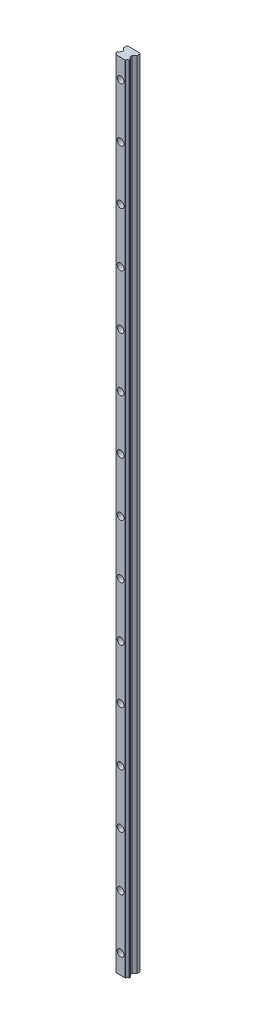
SolidWorks part; units mm, degrees
ref_plane "Front Plane" through (0, 0, 0) normal (0, 0, 1) x (1, 0, 0)
ref_plane "Top Plane" through (0, 0, 0) normal (0, 1, 0) x (1, 0, 0)
ref_plane "Right Plane" through (0, 0, 0) normal (1, 0, 0) x (0, 0, -1)
imported_body "Imported3"
sketch "Sketch1" plane through (0, 1.7999, 0) normal (0, 1, 0) x (-1, 0, 0)
  line L0 (-22.3768, -10.8396) -> (-23, -10.8396)
  line L1 (-23, -10.8396) -> (-23, -10.8812)
  arc A0 (-23, -10.8812) -> (-22.3768, -10.8396) centre (-22.3564, -15.8396) cw
extrude "Cut-Extrude1" cut sketch "Sketch1" against normal blind 6
sketch "Sketch2" plane through (0, -32.7001, 0) normal (0, -1, 0) x (1, 0, 0)
  line L0 (23, -10.8396) -> (22.3768, -10.8396)
  line L1 (23, -10.8812) -> (23, -10.8396)
  arc A0 (22.3768, -10.8396) -> (23, -10.8812) centre (22.3564, -15.8396) cw
extrude "Cut-Extrude2" cut sketch "Sketch2" against normal blind 6
sketch "Sketch3" plane through (0, -32.7001, 0) normal (0, -1, 0) x (1, 0, 0)
  line L0 (23, -7.3502) -> (23, -10.8396)
  line L1 (23, -10.8396) -> (16, -10.8396)
  line L2 (16, -10.8396) -> (16, -19.65)
  line L3 (16, -19.65) -> (-16, -19.65)
  line L4 (-16, -19.65) -> (-16, -6.8502)
  line L5 (-16, -6.8502) -> (23.5, -6.8502)
  line L6 (23.5, -6.8502) -> (23, -7.3502)
extrude "Boss-Extrude1" add sketch "Sketch3" along normal blind 2.4
ref_plane "Plane1" through (0, -26.7001, 0) normal (0, -1, 0) x (1, 0, 0)
sketch "Sketch4" plane through (0, -26.7001, 0) normal (0, -1, 0) x (1, 0, 0)
  line L0 (22.336, -10.8396) -> (22.3768, -10.8396)
  arc A0 (22.3768, -10.8396) -> (22.336, -10.8396) centre (22.3564, -15.8396) ccw
extrude "Cut-Extrude3" cut sketch "Sketch4" against normal blind 22.5
sketch "Sketch5" plane through (0, -35.1001, 0) normal (0, -1, 0) x (1, 0, 0)
  line L0 (23.5, -6.8502) -> (23, -6.8502)
  line L1 (23, -6.8502) -> (23, -7.3502)
  line L2 (23, -7.3502) -> (23.5, -6.8502)
extrude "Cut-Extrude4" cut sketch "Sketch5" against normal blind 8.4
sketch "Sketch6" plane through (0, 1.7999, 0) normal (0, 1, 0) x (-1, 0, 0)
  line L0 (-23.5, -6.8502) -> (-23, -7.3502)
  line L1 (-23, -7.3502) -> (-23, -6.8502)
  line L2 (-23, -6.8502) -> (-23.5, -6.8502)
extrude "Cut-Extrude5" cut sketch "Sketch6" against normal blind 6
sketch "Sketch7" plane through (23, 0, 0) normal (1, 0, 0) x (0, 0, -1)
  line L0 (6.8502, 1.7999) -> (10.8396, 1.7999)
  line L1 (10.8396, 1.7999) -> (10.8396, -4.2001)
  line L2 (10.8396, -4.2001) -> (6.8502, -4.2001)
  line L3 (6.8502, -4.2001) -> (6.8502, 1.7999)
extrude "Boss-Extrude2" add sketch "Sketch7" along normal blind 0.5
sketch "Sketch8" plane through (0, 0, -19.65) normal (0, 0, -1) x (-1, 0, 0)
  line L0 (19, -4.2001) -> (20.8437, -4.2001)
  line L1 (20.8437, -4.2001) -> (20.8437, 1.7999)
  line L2 (20.8437, 1.7999) -> (16, 1.7999)
  arc A0 (16, 1.7999) -> (19, -4.2001) centre (19, -0.4501) ccw
extrude "Cut-Extrude6" cut sketch "Sketch8" against normal blind 7.5181
sketch "Sketch9" plane through (0, 0, -12.1319) normal (0, 0, -1) x (-1, 0, 0)
  line L0 (19, -4.2001) -> (20.8437, -4.2001)
  line L1 (20.8437, -4.2001) -> (20.8437, 1.7999)
  line L2 (20.8437, 1.7999) -> (16, 1.7999)
  arc A0 (16, 1.7999) -> (19, -4.2001) centre (19, -0.4501) ccw
extrude "Cut-Extrude7" cut sketch "Sketch9" against normal blind 1.2817
sketch "Sketch10" plane through (23, 0, 0) normal (1, 0, 0) x (0, 0, -1)
  line L0 (6.8502, -26.7001) -> (10.8396, -26.7001)
  line L1 (10.8396, -26.7001) -> (10.8396, -35.1001)
  line L2 (10.8396, -35.1001) -> (6.8502, -35.1001)
  line L3 (6.8502, -35.1001) -> (6.8502, -26.7001)
extrude "Boss-Extrude3" add sketch "Sketch10" along normal blind 0.5
sketch "Sketch11" plane through (0, 0, -6.8502) normal (0, 0, 1) x (1, 0, 0)
  line L0 (-20.8437, -35.1001) -> (-20.8437, 1.7999)
  line L1 (-20.8437, 1.7999) -> (23.5, 1.7999)
  line L2 (23.5, 1.7999) -> (23.5, -35.1001)
  line L3 (23.5, -35.1001) -> (-20.8437, -35.1001)
extrude "Boss-Extrude4" add sketch "Sketch11" along normal blind 7
sketch "Sketch12" plane through (0, 0, -10.8396) normal (0, 0, -1) x (-1, 0, 0)
  line L0 (-16, 1.7999) -> (-23.5, 1.7999)
  line L1 (-23.5, 1.7999) -> (-23.5, -4.2001)
  line L2 (-23.5, -4.2001) -> (-23, -4.2001)
  line L3 (-23, -4.2001) -> (-19, -4.2001)
  arc A0 (-19, -4.2001) -> (-16, 1.7999) centre (-19, -0.4501) ccw
extrude "Cut-Extrude8" cut sketch "Sketch12" against normal blind 3.4894
sketch "Sketch13" plane through (0, 0, -10.8396) normal (0, 0, -1) x (-1, 0, 0)
  line L0 (-16, -35.1001) -> (-16, -32.7001)
  line L1 (-19, -26.7001) -> (-23, -26.7001)
  line L2 (-23, -26.7001) -> (-23.5, -26.7001)
  line L3 (-23.5, -26.7001) -> (-23.5, -35.1001)
  line L4 (-23.5, -35.1001) -> (-16, -35.1001)
  arc A0 (-16, -32.7001) -> (-19, -26.7001) centre (-19, -30.4501) ccw
extrude "Cut-Extrude9" cut sketch "Sketch13" against normal blind 3.4894
sketch "Sketch14" plane through (0, 0, -7.3502) normal (0, 0, -1) x (-1, 0, 0)
  line L0 (-16, -35.1001) -> (-16, -32.7001)
  line L1 (-19, -26.7001) -> (-23.5, -26.7001)
  line L2 (-23.5, -26.7001) -> (-23.5, -35.1001)
  line L3 (-23.5, -35.1001) -> (-16, -35.1001)
  arc A0 (-16, -32.7001) -> (-19, -26.7001) centre (-19, -30.4501) ccw
extrude "Cut-Extrude10" cut sketch "Sketch14" against normal blind 0.5
sketch "Sketch15" plane through (-20.8437, 0, 0) normal (-1, 0, 0) x (0, 0, 1)
  line L0 (-10.8502, 1.7999) -> (0.1498, 1.7999)
  line L1 (0.1498, 1.7999) -> (0.1498, -35.1001)
  line L2 (0.1498, -35.1001) -> (-6.8502, -35.1001)
  line L3 (-6.8502, -35.1001) -> (-6.8502, -26.7001)
  line L4 (-6.8502, -26.7001) -> (-10.8502, -26.7001)
  line L5 (-10.8502, -26.7001) -> (-10.8502, 1.7999)
extrude "Boss-Extrude5" add sketch "Sketch15" along normal blind 2.6563
sketch "Sketch16" plane through (0, 0, -7.3502) normal (0, 0, -1) x (-1, 0, 0)
  line L0 (-16, 1.7999) -> (-23.5, 1.7999)
  line L1 (-23.5, 1.7999) -> (-23.5, -4.2001)
  line L2 (-23.5, -4.2001) -> (-19, -4.2001)
  arc A0 (-19, -4.2001) -> (-16, 1.7999) centre (-19, -0.4501) ccw
extrude "Cut-Extrude11" cut sketch "Sketch16" against normal blind 0.5
sketch "Sketch17" plane through (0, 0, -10.8502) normal (0, 0, -1) x (-1, 0, 0)
  line L0 (23.5, -4.2001) -> (23.5, 1.7999)
  line L1 (23.5, 1.7999) -> (16, 1.7999)
  line L2 (19, -4.2001) -> (23.5, -4.2001)
  arc A0 (16, 1.7999) -> (19, -4.2001) centre (19, -0.4501) ccw
extrude "Cut-Extrude12" cut sketch "Sketch17" against normal blind 4
sketch "Sketch18" plane through (0, 1.7999, 0) normal (0, 1, 0) x (-1, 0, 0)
  line L0 (-23.5, 0.1498) -> (23.5, 0.1498)
  line L1 (23.5, 0.1498) -> (23.5, -6.8502)
  line L2 (23.5, -6.8502) -> (16, -6.8502)
  line L3 (16, -6.8502) -> (16, -19.65)
  line L4 (16, -19.65) -> (-16, -19.65)
  line L5 (-16, -19.65) -> (-16, -6.8502)
  line L6 (-16, -6.8502) -> (-23.5, -6.8502)
  line L7 (-23.5, -6.8502) -> (-23.5, 0.1498)
extrude "Boss-Extrude6" add sketch "Sketch18" along normal blind 2.4
sketch "Sketch19" plane through (0, -35.1001, 0) normal (0, -1, 0) x (1, 0, 0)
  line L0 (-16, -19.65) -> (-15.5939, -19.65)
  line L1 (-16, -16.8291) -> (-16, -19.65)
  arc A0 (-15.5939, -19.65) -> (-16, -16.8291) centre (-25.5939, -19.65) ccw
extrude "Cut-Extrude13" cut sketch "Sketch19" against normal up to next
sketch "Sketch20" plane through (0, -35.1001, 0) normal (0, -1, 0) x (1, 0, 0)
  line L0 (16, -19.65) -> (16, -16.8291)
  line L1 (15.5939, -19.65) -> (16, -19.65)
  arc A0 (16, -16.8291) -> (15.5939, -19.65) centre (25.5939, -19.65) ccw
extrude "Cut-Extrude14" cut sketch "Sketch20" against normal up to next
sketch "Sketch21" plane through (0, -35.1001, 0) normal (0, -1, 0) x (1, 0, 0)
  line L0 (15.6, -19.65) -> (-15.6, -19.65)
  line L1 (-15.6, -19.65) -> (-15.6, -0.65)
  line L2 (-15.6, -0.65) -> (15.6, -0.65)
  line L3 (15.6, -0.65) -> (15.6, -19.65)
extrude "Boss-Extrude7" add sketch "Sketch21" along normal blind 8.5
sketch "Sketch22" plane through (0, 4.1999, 0) normal (0, 1, 0) x (-1, 0, 0)
  line L0 (15.5939, -19.65) -> (16, -19.65)
  line L1 (16, -19.65) -> (16, -16.8291)
  arc A0 (16, -16.8291) -> (15.5939, -19.65) centre (25.5939, -19.65) ccw
extrude "Cut-Extrude15" cut sketch "Sketch22" against normal up to next
sketch "Sketch23" plane through (0, 4.1999, 0) normal (0, 1, 0) x (-1, 0, 0)
  line L0 (-16, -16.8291) -> (-16, -19.65)
  line L1 (-16, -19.65) -> (-15.5939, -19.65)
  arc A0 (-15.5939, -19.65) -> (-16, -16.8291) centre (-25.5939, -19.65) ccw
extrude "Cut-Extrude16" cut sketch "Sketch23" against normal up to next
sketch "Sketch24" plane through (0, 4.1999, 0) normal (0, 1, 0) x (-1, 0, 0)
  line L0 (15.6, -19.65) -> (-15.6, -19.65)
  line L1 (-15.6, -19.65) -> (-15.6, -0.65)
  line L2 (-15.6, -0.65) -> (15.6, -0.65)
  line L3 (15.6, -0.65) -> (15.6, -19.65)
extrude "Boss-Extrude8" add sketch "Sketch24" along normal blind 8.5
sketch "Sketch25" plane through (0, 4.1999, 0) normal (0, 1, 0) x (-1, 0, 0)
  line L0 (-4.5004, 0.1498) -> (-13.5005, 0.1498)
  line L1 (-13.5005, 0.1498) -> (-13.0005, -0.3502)
  line L2 (-13.0005, -0.3502) -> (-5.0004, -0.3502)
  line L3 (-5.0004, -0.3502) -> (-4.5004, 0.1498)
extrude "Cut-Extrude17" cut sketch "Sketch25" against normal through all
sketch "Sketch26" plane through (0, 4.1999, 0) normal (0, 1, 0) x (-1, 0, 0)
  line L0 (13.5, 0.1498) -> (4.5, 0.1498)
  line L1 (4.5, 0.1498) -> (4.9998, -0.35)
  line L2 (4.9998, -0.35) -> (13.0002, -0.35)
  line L3 (13.0002, -0.35) -> (13.5, 0.1498)
extrude "Cut-Extrude18" cut sketch "Sketch26" against normal through all
sketch "Sketch27" plane through (0, 12.6999, 0) normal (0, 1, 0) x (-1, 0, 0)
  line L0 (7.4011, -19.65) -> (4.73, -16.9789)
  line L1 (4.73, -16.9789) -> (4.73, -15.0209)
  line L2 (4.73, -15.0209) -> (5.4472, -14.3037)
  line L3 (7.43, -12.6044) -> (7.43, -10.8955)
  line L4 (5.4544, -8.9199) -> (-5.4544, -8.9199)
  line L5 (-7.43, -10.8955) -> (-7.43, -12.6044)
  line L6 (-5.4472, -14.3037) -> (-4.73, -15.0209)
  line L7 (-4.73, -15.0209) -> (-4.73, -16.9789)
  line L8 (-4.73, -16.9789) -> (-7.4011, -19.65)
  line L9 (-7.4011, -19.65) -> (7.4011, -19.65)
  arc A0 (5.4472, -14.3037) -> (7.43, -12.6044) centre (7.2449, -14.3948) cw
  arc A1 (7.43, -10.8955) -> (5.4544, -8.9199) centre (7.2449, -9.105) cw
  arc A2 (-5.4544, -8.9199) -> (-7.43, -10.8955) centre (-7.2449, -9.105) cw
  arc A3 (-7.43, -12.6044) -> (-5.4472, -14.3037) centre (-7.2449, -14.3948) cw
extrude "Cut-Extrude19" cut sketch "Sketch27" against normal through all
hole_wizard "CBORE for M2.5 Hex Head Machine Screw1" positions "Sketch29" profile "Sketch28" counterbore size "M2.5" standard "Ansi Metric"
sketch "Sketch29" plane through (0, 12.6999, 0) normal (0, 1, 0) x (-1, 0, 0)
  point P0 (-12.1, -11.7499)
  point P1 (12.1, -11.7499)
sketch "Sketch28" plane through (12.1, 12.6999, -11.7499) normal (1, 0, 0) x (0, 0, 1)
  line L0 (0, 0) -> (0, 6)
  line L1 (0, 6) -> (1.5, 6)
  line L2 (1.5, 6) -> (1.5, 2)
  line L3 (1.5, 2) -> (2.9, 2)
  line L4 (2.9, 2) -> (2.9, 0)
  line L5 (2.9, 0) -> (0, 0)
  line L10 (0, 6) -> (-1.5, 6) construction
  line L11 (0, -6.35) -> (0, 107.95) construction
  dimension "Hole Dia." = 3
  dimension "Hole Depth" = 6
  dimension "C'Bore Dia." = 5.8
  dimension "C'Bore Depth" = 2
  dimension "Drill Angle" = 180
hole_wizard "CBORE for M2.5 Hex Head Machine Screw2" positions "Sketch31" profile "Sketch30" counterbore size "M2.5" standard "Ansi Metric"
sketch "Sketch31" plane through (0, -43.6001, 0) normal (0, -1, 0) x (1, 0, 0)
  point P0 (12.1, -11.7499)
  point P1 (-12.1, -11.7499)
sketch "Sketch30" plane through (12.1, -43.6001, -11.7499) normal (1, 0, 0) x (0, 0, -1)
  line L0 (0, 0) -> (0, 6)
  line L1 (0, 6) -> (1.5, 6)
  line L2 (1.5, 6) -> (1.5, 2)
  line L3 (1.5, 2) -> (2.9, 2)
  line L4 (2.9, 2) -> (2.9, 0)
  line L5 (2.9, 0) -> (0, 0)
  line L10 (0, 6) -> (-1.5, 6) construction
  line L11 (0, -6.35) -> (0, 107.95) construction
  dimension "Hole Dia." = 3
  dimension "Hole Depth" = 6
  dimension "C'Bore Dia." = 5.8
  dimension "C'Bore Depth" = 2
  dimension "Drill Angle" = 180
hole_wizard "Ø5.0 (5) Diameter Hole1" positions "Sketch33" profile "Sketch32" hole size "Ø5.0" standard "Ansi Metric"
sketch "Sketch33" plane through (0, 0, -6.8502) normal (0, 0, -1) x (-1, 0, 0)
  point P0 (-19, -30.4501)
  point P1 (19, -0.4501)
sketch "Sketch32" plane through (19, -30.4501, -6.8502) normal (1, 0, 0) x (0, 1, 0)
  line L0 (0, 0) -> (0, 7)
  line L1 (0, 7) -> (2.5, 7)
  line L2 (2.5, 7) -> (2.5, 0)
  line L5 (2.5, 0) -> (0, 0)
  line L11 (0, -6.35) -> (0, 107.95) construction
  dimension "Thru Hole Dia." = 5
  dimension "Thru Hole Depth" = 7
hole_wizard "Ø5.0 (5) Diameter Hole2" positions "Sketch35" profile "Sketch34" hole size "Ø5.0" standard "Ansi Metric"
sketch "Sketch35" plane through (0, 0, 0.1498) normal (0, 0, 1) x (1, 0, 0)
  point P0 (19, -0.4501)
  point P1 (-19, -30.4501)
sketch "Sketch34" plane through (19, -0.4501, 0.1498) normal (1, 0, 0) x (0, -1, 0)
  line L0 (0, 0) -> (0, 19.7999)
  line L1 (0, 19.7999) -> (2.5, 19.7999)
  line L2 (2.5, 19.7999) -> (2.5, 0)
  line L5 (2.5, 0) -> (0, 0)
  line L11 (0, -6.35) -> (0, 107.95) construction
  dimension "Thru Hole Dia." = 5
  dimension "Thru Hole Depth" = 19.7999
chamfer "Chamfer2" distance 0.2622 angle 45 4 edges at (-5.4544, -15.4501, -8.9199) (-7.43, -15.4501, -12.6044) (7.43, -15.4501, -10.8955) (7.43, -15.4501, -12.6044)
chamfer "Chamfer3" distance 0.8496 angle 45 8 edges at (15.25, -30.4501, -19.65) (15.7712, -32.3573, -17.775) (15.5939, -15.4501, -19.65) (15.25, -0.4501, -19.65)
chamfer "Chamfer4" distance 0.9997 angle 45 1 edges at (23.5, -15.4501, 0.1498)
chamfer "Chamfer5" distance 0.5 angle 45 4 edges at (15.6, 8.4499, -0.65) (-15.6, 8.4499, -0.65) (15.6, -39.3501, -0.65) (-15.6, -39.3501, -0.65)
chamfer "Chamfer6" distance 0.2622 angle 45 2 edges at (-7.43, -15.4501, -10.8955) (5.4544, -15.4501, -8.9199)
chamfer "Chamfer7" distance 0.8496 angle 45 5 edges at (-15.25, -0.4501, -19.65) (-15.5939, -15.4501, -19.65) (-15.25, -30.4501, -19.65)
fillet "Fillet1" radius 0.5 2 edges at (23, -15.4501, -7.3502)
fillet "Fillet2" radius 1 2 edges at (23, -15.4501, -10.8812) (-23.5, -15.4501, -10.8502)
fillet "Fillet3" radius 5 1 edges at (-20.8437, -15.4501, -10.8502)
imported_body "Imported5"
sketch "Sketch36" plane through (0, -95.4501, 0) normal (0, -1, 0) x (1, 0, 0)
  line L20 (5.4472, -9.1961) -> (5.171, -8.9199)
  line L21 (5.171, -8.9199) -> (-5.171, -8.9199)
  line L22 (-5.171, -8.9199) -> (-5.4472, -9.1961)
  line L23 (-7.1538, -10.9027) -> (-7.43, -11.1789)
  line L24 (-7.43, -11.1789) -> (-7.43, -12.3209)
  line L25 (-7.43, -12.3209) -> (-7.1538, -12.5971)
  line L26 (-5.4472, -14.3037) -> (-4.73, -15.0209)
  line L27 (-4.73, -15.0209) -> (-4.73, -16.9789)
  line L28 (-4.73, -16.9789) -> (-7.5, -19.7489)
  line L29 (-7.5, -19.7489) -> (-7.5, -23.1499)
  line L30 (-7.5, -23.1499) -> (-6.8, -23.8499)
  line L31 (-6.8, -23.8499) -> (6.8, -23.8499)
  line L32 (6.8, -23.8499) -> (7.5, -23.1499)
  line L33 (7.5, -23.1499) -> (7.5, -19.7489)
  line L34 (7.5, -19.7489) -> (4.73, -16.9789)
  line L35 (4.73, -16.9789) -> (4.73, -15.0209)
  line L36 (4.73, -15.0209) -> (5.4472, -14.3037)
  line L37 (7.1538, -12.5971) -> (7.43, -12.3209)
  line L38 (7.43, -12.3209) -> (7.43, -11.1789)
  line L39 (7.43, -11.1789) -> (7.1538, -10.9027)
  line L40 (5.4472, -9.1961) -> (5.171, -8.9199)
  line L41 (5.171, -8.9199) -> (-5.171, -8.9199)
  line L42 (-5.171, -8.9199) -> (-5.4472, -9.1961)
  line L43 (-7.1538, -10.9027) -> (-7.43, -11.1789)
  line L44 (-7.43, -11.1789) -> (-7.43, -12.3209)
  line L45 (-7.43, -12.3209) -> (-7.1538, -12.5971)
  line L46 (-5.4472, -14.3037) -> (-4.73, -15.0209)
  line L47 (-4.73, -15.0209) -> (-4.73, -16.9789)
  line L48 (-4.73, -16.9789) -> (-7.5, -19.7489)
  line L49 (-7.5, -19.7489) -> (-7.5, -23.1499)
  line L50 (-7.5, -23.1499) -> (-6.8, -23.8499)
  line L51 (-6.8, -23.8499) -> (6.8, -23.8499)
  line L52 (6.8, -23.8499) -> (7.5, -23.1499)
  line L53 (7.5, -23.1499) -> (7.5, -19.7489)
  line L54 (7.5, -19.7489) -> (4.73, -16.9789)
  line L55 (4.73, -16.9789) -> (4.73, -15.0209)
  line L56 (4.73, -15.0209) -> (5.4472, -14.3037)
  line L57 (7.1538, -12.5971) -> (7.43, -12.3209)
  line L58 (7.43, -12.3209) -> (7.43, -11.1789)
  line L59 (7.43, -11.1789) -> (7.1538, -10.9027)
  arc A4 (-7.1538, -10.9027) -> (-5.4472, -9.1961) centre (-7.2449, -9.105) ccw
  arc A5 (-5.4472, -14.3037) -> (-7.1538, -12.5971) centre (-7.2449, -14.3948) ccw
  arc A6 (7.1538, -12.5971) -> (5.4472, -14.3037) centre (7.2449, -14.3948) ccw
  arc A7 (5.4472, -9.1961) -> (7.1538, -10.9027) centre (7.2449, -9.105) ccw
  arc A8 (-7.1538, -10.9027) -> (-5.4472, -9.1961) centre (-7.2449, -9.105) ccw
  arc A9 (-5.4472, -14.3037) -> (-7.1538, -12.5971) centre (-7.2449, -14.3948) ccw
  arc A10 (7.1538, -12.5971) -> (5.4472, -14.3037) centre (7.2449, -14.3948) ccw
  arc A11 (5.4472, -9.1961) -> (7.1538, -10.9027) centre (7.2449, -9.105) ccw
  dimension "D1" = 0
extrude "Boss-Extrude9" add sketch "Sketch36" along normal blind 883 separate body
hole_wizard "CBORE for M6 Hex Head Bolt1" positions "Sketch38" profile "Sketch37" counterbore size "M6" standard "Ansi Metric"
sketch "Sketch38" plane through (0, 0, -8.9199) normal (0, 0, 1) x (1, 0, 0)
  line L0 (5.171, -95.4501) -> (-5.171, -95.4501) construction
  point P0 (0, -116.9501)
  point P5 (0, -95.4501)
  point P6 (0, -176.9501)
  point P14 (0, -236.9501)
  point P15 (0, -296.9501)
  point P16 (0, -356.9501)
  point P17 (0, -416.9501)
  point P18 (0, -476.9501)
  point P19 (0, -536.9501)
  point P20 (0, -596.9501)
  point P21 (0, -656.9501)
  point P22 (0, -716.9501)
  point P23 (0, -776.9501)
  point P24 (0, -836.9501)
  point P25 (0, -896.9501)
  point P26 (0, -956.9501)
  dimension "D1" = 21.5
  dimension "D2" = 0
  dimension "D4" = 60
  dimension "D3" = 14
sketch "Sketch37" plane through (0, -116.9501, -8.9199) normal (1, 0, 0) x (0, -1, 0)
  line L0 (0, 0) -> (0, 14.93)
  line L1 (0, 14.93) -> (2.25, 14.93)
  line L3 (2.25, 14.93) -> (2.25, 5.3)
  line L4 (2.25, 5.3) -> (3.75, 5.3)
  line L5 (3.75, 5.3) -> (3.75, 0)
  line L7 (3.75, 0) -> (0, 0)
  line L11 (0, -6.35) -> (0, 107.95) construction
  dimension "Thru Hole Dia." = 4.5
  dimension "Thru Hole Depth" = 14.93
  dimension "C'Bore Dia." = 7.5
  dimension "C'Bore Depth" = 5.3
delete or keep bodies "Body-Delete2" type delete bodies bodies 134 136
